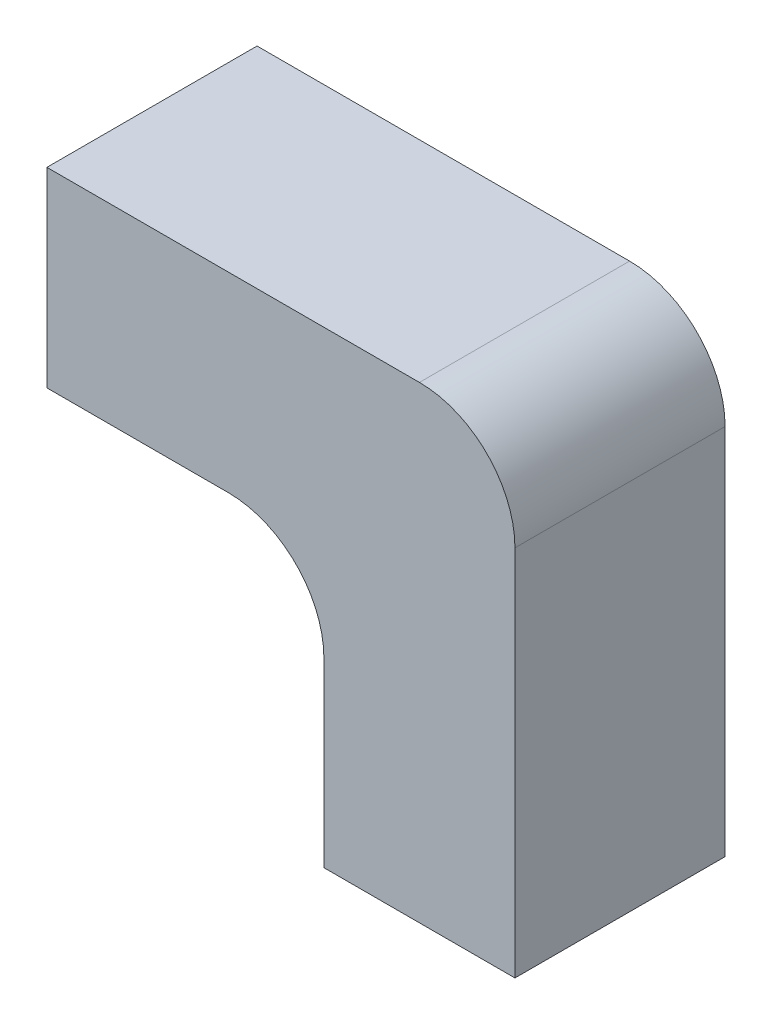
SolidWorks part; units mm, degrees
ref_plane "Front Plane" through (0, 0, 0) normal (0, 0, 1) x (1, 0, 0)
ref_plane "Top Plane" through (0, 0, 0) normal (0, 1, 0) x (1, 0, 0)
ref_plane "Right Plane" through (0, 0, 0) normal (1, 0, 0) x (0, 0, -1)
sketch "Sketch1" plane through (0, 0, 0) normal (0, 0, 1) x (1, 0, 0)
  line L0 (-1.5514, -0.2683) -> (1.3486, -0.2683)
  line L1 (-1.5514, 1.7317) -> (3.3486, 1.7317)
  line L2 (-1.5514, 1.7317) -> (-1.5514, -0.2683)
  line L3 (1.3486, -0.2683) -> (1.3486, -3.1683)
  line L4 (3.3486, 1.7317) -> (3.3486, -3.1683)
  line L5 (1.3486, -3.1683) -> (3.3486, -3.1683)
  dimension "D1" = 4.9
  dimension "D2" = 4.9
  dimension "D3" = 2
  dimension "D4" = 2
extrude "Boss-Extrude1" add sketch "Sketch1" along normal blind 2.2
fillet "Fillet1" radius 1 2 edges at (1.3486, -0.2683, 1.1) (3.3486, 1.7317, 1.1)
